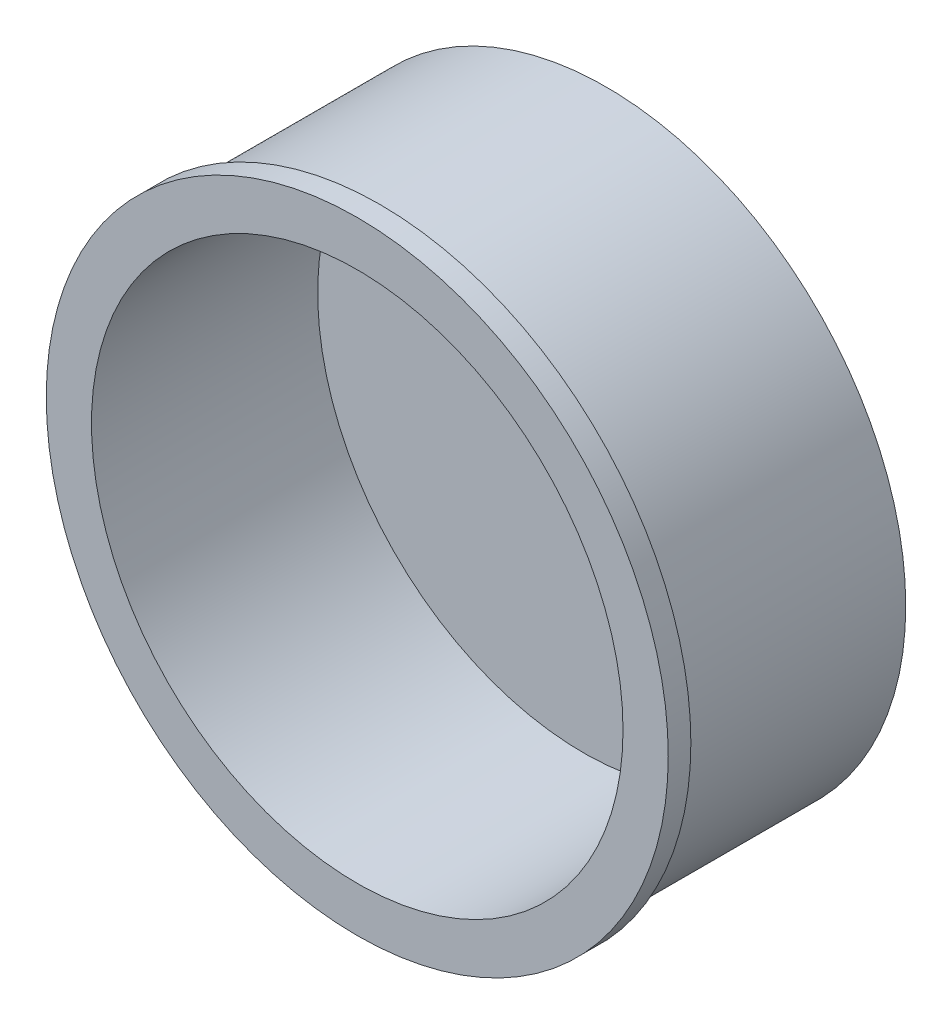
SolidWorks part; units mm, degrees
ref_plane "Plan de face" through (0, 0, 0) normal (0, 0, 1) x (1, 0, 0)
ref_plane "Plan de dessus" through (0, 0, 0) normal (0, 1, 0) x (1, 0, 0)
ref_plane "Plan de droite" through (0, 0, 0) normal (1, 0, 0) x (0, 0, -1)
ref_plane "Plan1" through (0, 246.0337, 0) normal (0, 1, 0) x (-1, 0, 0)
sketch "Esquisse2" plane through (0, 246.0337, 0) normal (0, 1, 0) x (-1, 0, 0)
  line L0 (36.744, 1) -> (34.744, 1)
  line L1 (34.744, 1) -> (34.744, -9)
  line L2 (34.744, -9) -> (22.994, -9)
  line L3 (22.994, -9) -> (22.994, -10)
  line L4 (22.994, -10) -> (36.244, -10)
  line L7 (36.244, -10) -> (36.244, 0)
  line L8 (36.244, 0) -> (36.744, 0)
  line L9 (36.744, 0) -> (36.744, 1)
  line L10 (22.994, 0) -> (22.994, -21.1859) construction
  dimension "D1" = 1
  dimension "D2" = 27.5
  dimension "D3" = 23.5
  dimension "D4" = 1
  dimension "D5" = 11
revolve "Révolution1" add sketch "Esquisse2" angle 360 about L10
